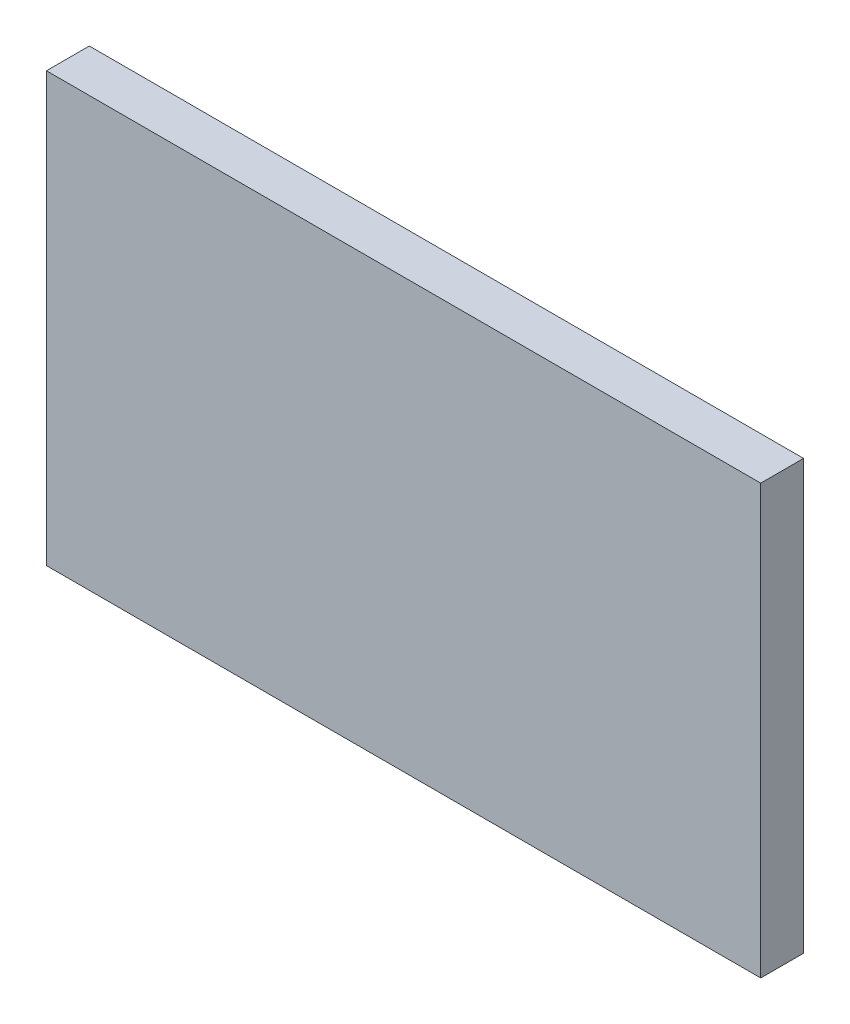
SolidWorks part; units mm, degrees
ref_plane "Front" through (0, 0, 0) normal (0, 0, 1) x (1, 0, 0)
ref_plane "Top" through (0, 0, 0) normal (0, 1, 0) x (1, 0, 0)
ref_plane "Right" through (0, 0, 0) normal (1, 0, 0) x (0, 0, -1)
sketch "Sketch1" plane through (0, 0, 0) normal (0, 0, 1) x (1, 0, 0)
  line L1 (0, 0) -> (50, 0)
  line L2 (0, 0) -> (0, 30)
  line L3 (0, 30) -> (50, 30)
  line L4 (50, 0) -> (50, 30)
  dimension "D1" = 50
  dimension "D2" = 30
extrude "Extrude1" add sketch "Sketch1" along normal blind 3
sketch "Sketch2" plane through (0, 0, 3) normal (0, 0, 1) x (1, 0, 0)
  line L0 (0, 0) -> (50, 30) construction
  line L1 (8.0012, 9.6454) -> (31.9652, 24.0238)
  line L2 (31.9652, 24.0238) -> (8.0012, 24.0238)
  line L3 (8.0012, 24.0238) -> (8.0012, 9.6454)
  line L4 (19.2629, 6.7131) -> (40.6083, 19.5203)
  line L5 (40.6083, 19.5203) -> (40.6083, 6.7131)
  line L6 (40.6083, 6.7131) -> (19.2629, 6.7131)
